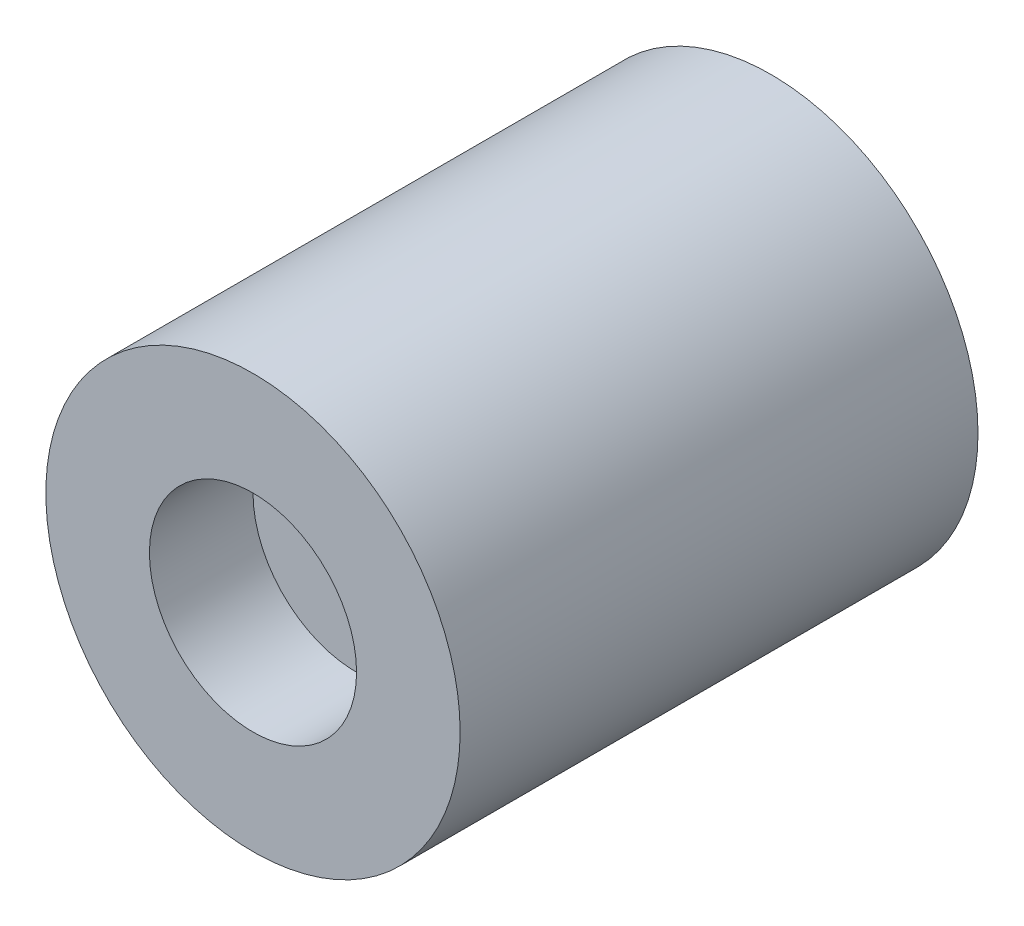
SolidWorks part; units mm, degrees
ref_plane "前基準面" through (0, 0, 0) normal (0, 0, 1) x (1, 0, 0)
ref_plane "上基準面" through (0, 0, 0) normal (0, 1, 0) x (1, 0, 0)
ref_plane "右基準面" through (0, 0, 0) normal (1, 0, 0) x (0, 0, -1)
sketch "草圖1" plane through (0, 0, 0) normal (0, 0, 1) x (1, 0, 0)
  circle A0 centre (0, 0) radius 10
  dimension "D1" = 20
extrude "填料-伸長1" add sketch "草圖1" along normal blind 25
sketch "草圖2" plane through (0, 0, 25) normal (0, 0, 1) x (1, 0, 0)
  circle A0 centre (0, 0) radius 5
  dimension "D1" = 10
extrude "除料-伸長1" cut sketch "草圖2" against normal blind 5
hole_wizard "M6 螺紋孔1" positions "草圖4" profile "草圖3" tap size "M6" standard "IS"
sketch "草圖4" plane through (0, 0, 0) normal (0, 0, -1) x (-1, 0, 0)
  point P0 (0, 0)
sketch "草圖3" plane through (0, 0, 0) normal (1, 0, 0) x (0, 1, 0)
  line L0 (0, 0) -> (0, 16.5022)
  line L1 (0, 16.5022) -> (2.5, 15)
  line L2 (2.5, 15) -> (2.5, 0)
  line L5 (2.5, 0) -> (0, 0)
  line L10 (0, 16.5022) -> (-2.5, 15) construction
  line L11 (0, -6.35) -> (0, 107.95) construction
  dimension "螺孔鑽直徑" = 5
  dimension "螺孔鑽深度" = 15
  dimension "導頭角度" = 118
